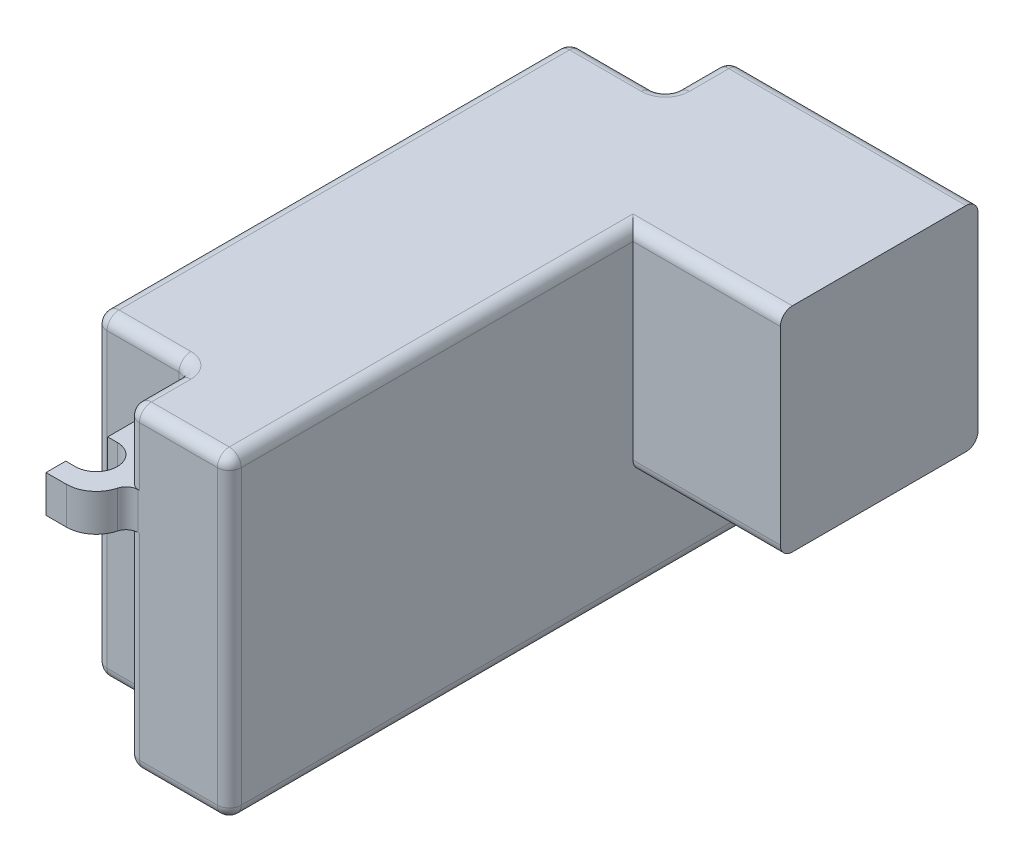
SolidWorks part; units mm, degrees
ref_plane "Plan de face" through (0, 0, 0) normal (0, 0, 1) x (1, 0, 0)
ref_plane "Plan de dessus" through (0, 0, 0) normal (0, 1, 0) x (1, 0, 0)
ref_plane "Plan de droite" through (0, 0, 0) normal (1, 0, 0) x (0, 0, -1)
sketch "Esquisse1" plane through (0, 0, 0) normal (0, 1, 0) x (1, 0, 0)
  line L0 (0, -3.2221) -> (0, 70.5335) construction
  line L1 (-8.056, 0) -> (69.1442, 0) construction
  line L2 (16.5, -3.2221) -> (16.5, 65.8812) construction
  line L3 (-8.056, 50.2) -> (69.1442, 50.2) construction
  line L4 (56.3221, 25.1) -> (14.565, 25.1) construction
  line L5 (12.7495, 33.7) -> (48.3792, 33.7) construction
  line L6 (8, 59.4134) -> (8, -3.2221) construction
  line L7 (-8.056, 44.9) -> (10.934, 44.9) construction
  line L8 (28.8, 70.5335) -> (28.8, 31.4997) construction
  line L9 (0, 44.9) -> (8, 44.9)
  line L10 (8, 44.9) -> (8, 50.2)
  line L11 (8, 50.2) -> (28.8, 50.2)
  line L12 (8, 5.3) -> (8, 0)
  line L13 (0, 5.3) -> (8, 5.3)
  line L14 (0, 44.9) -> (0, 5.3)
  line L15 (8, 0) -> (16.5, 0)
  line L16 (16.5, 0) -> (16.5, 33.7)
  line L17 (16.5, 33.7) -> (28.8, 33.7)
  line L18 (28.8, 33.7) -> (28.8, 50.2)
  dimension "D1" = 16.5
  dimension "D2" = 50.2
  dimension "D3" = 25.1
  dimension "D4" = 28.8
  dimension "D5" = 16.5
  dimension "D6" = 5.3
  dimension "D7" = 8
extrude "Boss.-Extru.1" add sketch "Esquisse1" along normal blind 26.4
sketch "Esquisse2" plane through (0, 0, -50.2) normal (0, 0, -1) x (-1, 0, 0)
  line L0 (5.398, 0) -> (-29.9381, 0) construction
  line L1 (5.398, 26.4) -> (-29.9381, 26.4) construction
  line L2 (5.398, 8.6) -> (-29.9381, 8.6) construction
  line L3 (0, -3.9443) -> (0, 33.9059) construction
  line L4 (-16.5, -3.9443) -> (-16.5, 33.9059) construction
  line L5 (-28.8, 29.5063) -> (-28.8, -3.9443) construction
  line L7 (-28.8, 0) -> (-16.5, 0)
  line L8 (-28.8, 0) -> (-28.8, 8.6)
  line L9 (-28.8, 8.6) -> (-16.5, 8.6)
  line L10 (-16.5, 0) -> (-16.5, 8.6)
  dimension "D1" = 17.8
  dimension "D2" = 16.5
extrude "Enlèv. mat.-Extru.1" cut sketch "Esquisse2" against normal blind 16.5
sketch "Esquisse3" plane through (8, 0, 0) normal (-1, 0, 0) x (0, 0, 1)
  line L0 (0, -2.7572) -> (0, 28.3191) construction
  line L1 (-50.2, -2.7572) -> (-50.2, 28.3191) construction
  line L2 (7.6174, 26.4) -> (-56.1414, 26.4) construction
  line L3 (-56.1414, 20.5) -> (7.6174, 20.5) construction
  line L4 (7.6174, 17.4) -> (-56.1414, 17.4) construction
  line L5 (-5.3, 33.3472) -> (-5.3, 14.7713) construction
  line L6 (-5.3, 26.4) -> (-5.3, 0) construction
  line L7 (2.6, 33.3472) -> (2.6, 14.7713) construction
  line L9 (-5.3, 17.4) -> (2.6, 17.4)
  line L10 (-5.3, 17.4) -> (-5.3, 20.5)
  line L11 (-5.3, 20.5) -> (2.6, 20.5)
  line L12 (2.6, 17.4) -> (2.6, 20.5)
  dimension "D1" = 5.9
  dimension "D2" = 3.1
  dimension "D3" = 7.9
extrude "Boss.-Extru.2" add sketch "Esquisse3" along normal blind 4.2
ref_plane "Plan1" through (0, 0, -25.1) normal (0, 0, 1) x (1, 0, 0)
sketch "Esquisse4" plane through (0, 20.5, 0) normal (0, 1, 0) x (1, 0, 0)
  line L0 (3.8, -3.3571) -> (3.8, 3.7426) construction
  line L1 (3.8, -2.6) -> (3.8, 5.3) construction
  line L2 (0.277, -2.6) -> (8, -2.6) construction
  line L3 (0.277, -0.95) -> (5.4805, -0.95) construction
  line L4 (2.9167, 0.8) -> (6.6638, 0.8) construction
  line L5 (-0.7849, 5.3) -> (6.6638, 5.3) construction
  line L6 (0, 5.3) -> (8, 5.3) construction
  line L7 (8, -2.6) -> (8, 7.247) construction
  line L8 (6.35, 7.247) -> (6.35, 0) construction
  line L9 (4.6, 7.247) -> (4.6, -1.3243) construction
  line L10 (4.6, 2.55) -> (3.8, 2.55)
  line L11 (3.8, 2.55) -> (3.8, -0.95)
  line L12 (3.8, -0.95) -> (4.6, -0.95)
  arc A0 (4.6, -0.95) -> (4.6, 2.55) centre (4.6, 0.8) ccw
  dimension "D1" = 1.75
  dimension "D2" = 1.65
  dimension "D3" = 1.65
  dimension "D4" = 1.75
extrude "Enlèv. mat.-Extru.2" cut sketch "Esquisse4" against normal blind 3.1
fillet "Congé1" radius 2.5 1 edges at (8, 18.95, 2.6)
mirror "Symétrie1" about plane through (0, 0, -25.1) normal (0, 0, 1) of "Congé1", "Enlèv. mat.-Extru.2", "Boss.-Extru.2"
sketch "Esquisse5" plane through (0, 0, 0) normal (-1, 0, 0) x (0, 0, 1)
  line L0 (6.7106, 26.4) -> (-28.0763, 26.4) construction
  line L1 (6.7106, 8.4) -> (-33.0458, 8.4) construction
  line L2 (0, -4.3027) -> (0, 34.58) construction
  line L3 (-25.1, 34.58) -> (-25.1, -4.3027) construction
  circle A0 centre (-25.1, 8.4) radius 2.1
  dimension "D1" = 18
  dimension "D2" = 25.1
extrude "Boss.-Extru.3" add sketch "Esquisse5" along normal blind 0.5
sketch "Esquisse6" plane through (-0.5, 0, 0) normal (-1, 0, 0) x (0, 0, 1)
  line L1 (-25.1, 10.5) -> (-26.9187, 9.45)
  line L2 (-26.9187, 9.45) -> (-26.9187, 7.35)
  line L3 (-26.9187, 7.35) -> (-25.1, 6.3)
  line L4 (-25.1, 6.3) -> (-23.2813, 7.35)
  line L5 (-23.2813, 7.35) -> (-23.2813, 9.45)
  line L6 (-23.2813, 9.45) -> (-25.1, 10.5)
  circle A0 centre (-25.1, 8.4) radius 1.8187 construction
  circle A2 centre (-25.1, 8.4) radius 2.1 construction
extrude "Boss.-Extru.4" add sketch "Esquisse6" along normal blind 11
sketch "Esquisse7" plane through (-11.5, 0, 0) normal (-1, 0, 0) x (0, 0, 1)
  circle A0 centre (-25.1, 8.4) radius 1.2
extrude "Boss.-Extru.5" add sketch "Esquisse7" along normal blind 4.2
fillet "Congé2" radius 1 31 edges at (16.5, 0, -25.1) (22.65, 8.6, -33.7) (16.5, 26.4, -16.85) (8, 23.45, -44.9) (8, 8.7, -44.9) (8, 23.45, -5.3) (8, 8.7, -5.3) (16.5, 13.2, 0) (8, 23.45, 0) (8, 8.7, 0) (12.25, 0, 0) (8, 0, -2.65) (4, 0, -5.3) (22.65, 8.6, -50.2) (16.5, 4.3, -50.2) (12.25, 26.4, 0) (22.65, 26.4, -33.7) (0, 13.2, -5.3) (0, 0, -25.1) (4, 0, -44.9) (12.25, 0, -50.2) (8, 0, -47.55) (0, 13.2, -44.9) (8, 23.45, -50.2) (8, 8.7, -50.2) (8, 26.4, -2.65) (4, 26.4, -5.3) (0, 26.4, -25.1) (4, 26.4, -44.9) (8, 26.4, -47.55) (18.4, 26.4, -50.2)
fillet "Congé3" radius 1 2 edges at (8, 18.95, 0) (8, 18.95, -50.2)
